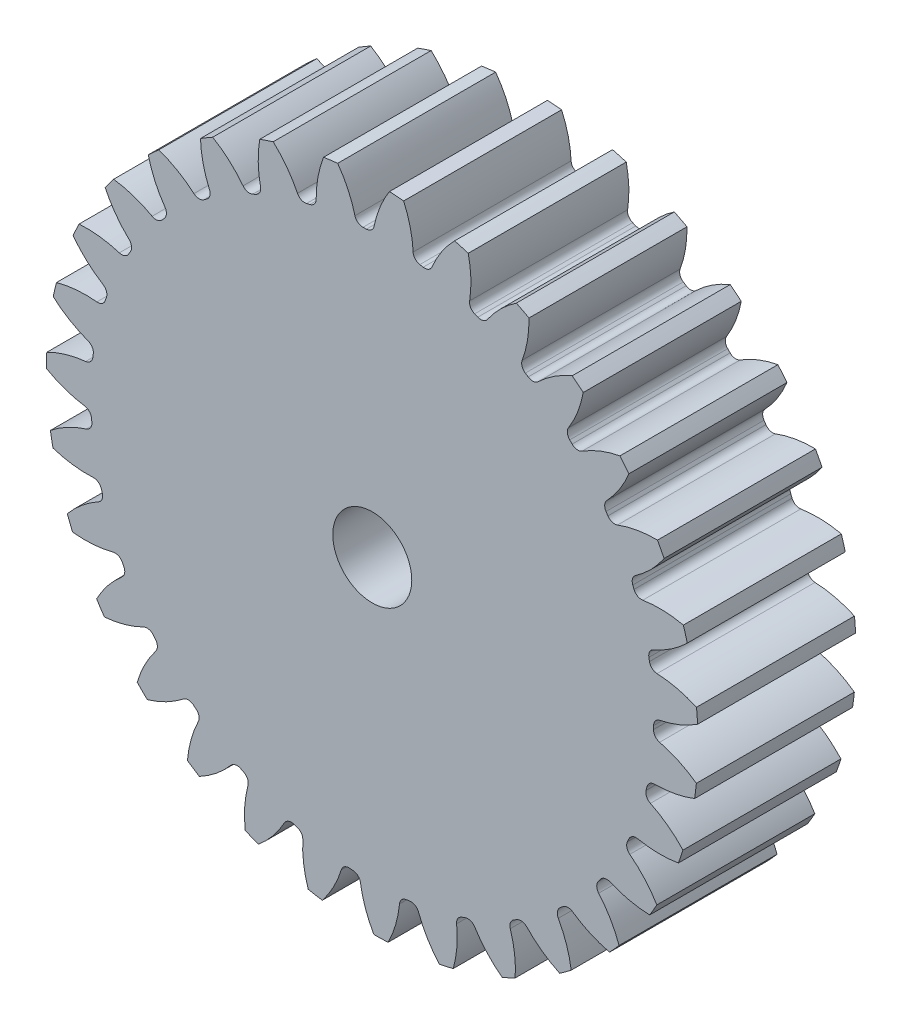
SolidWorks part; units mm, degrees
ref_plane "Front" through (0, 0, 0) normal (0, 0, 1) x (1, 0, 0)
ref_plane "Top" through (0, 0, 0) normal (0, 1, 0) x (1, 0, 0)
ref_plane "Right" through (0, 0, 0) normal (1, 0, 0) x (0, 0, -1)
sketch "Sketch3" plane through (0, 0, 0) normal (0, 0, 1) x (1, 0, 0)
  circle A0 centre (0, 0) radius 209.55
  dimension "od" = 419.1
extrude "gearBody" add sketch "Sketch3" along normal blind 101.6
sketch "Sketch2" plane through (0, 0, 0) normal (0, 0, 1) x (1, 0, 0)
  line L0 (0, 0) -> (170.8978, 70.7882) construction
  line L1 (208.7457, -21.8455) -> (0, 0) construction
  line L2 (0, 0) -> (36.3143, 0) construction
  line L3 (196.7801, 5.2441) -> (196.3061, -14.623) construction
  line L5 (196.5431, -4.6894) -> (0, 0) construction
  line L7 (0, 0) -> (184.9785, 0) construction
  arc A0 (184.9703, 1.7384) -> (184.6769, -10.558) centre (0, 0) ccw construction
  arc A1 (209.2257, 11.6537) -> (208.4318, -21.6188) centre (0, 0) ccw construction
  arc A2 (196.7801, 5.2441) -> (196.3061, -14.623) centre (0, 0) ccw construction
  arc A3 (180.8938, -5.4216) -> (180.9465, -3.2118) centre (0, 0) ccw
  arc A4 (208.7457, -21.8455) -> (184.7802, -10.5843) centre (167.3273, -78.8581) ccw
  arc A5 (208.7457, -21.8455) -> (209.55, 11.8651) centre (0, 0) ccw
  arc A6 (209.55, 11.8651) -> (185.0747, 1.7597) centre (170.8978, 70.7882) cw
  arc A7 (180.9465, -3.2118) -> (185.0747, 1.7597) centre (186.1146, -3.3035) cw
  arc A8 (184.7802, -10.5843) -> (180.8938, -5.4216) centre (186.0604, -5.5764) cw
  point P6 (209.55, 11.8651)
  point P22 (208.7457, -21.8455)
  dimension "baseDia" = 369.957
  dimension "od" = 419.1
  dimension "pd" = 393.7
  dimension "rd" = 361.95
  dimension "rFillet" = 5.1689
  dimension "pointX" = 209.55
  dimension "pointY" = 11.8651
  dimension "CTT" = 19.8672
  dimension "flankCenterAngle" = 22.5
extrude "toothCut" cut sketch "Sketch2" along normal through all
pattern_circular "CirPattern1" count 31 over 360 about axis through (0, 0, 0) along (0, 0, 1) of "toothCut"
sketch "hub1Dia" plane through (0, 0, 0) normal (0, 0, -1) x (-1, 0, 0)
  circle A0 centre (0, 0) radius 12.7
  dimension "hub1Dia" = 25.4
sketch "hub2Dia" plane through (0, 0, 101.6) normal (0, 0, 1) x (1, 0, 0)
  circle A0 centre (0, 0) radius 12.7
  dimension "hub2dia" = 25.4
sketch "boreDia" plane through (0, 0, 0) normal (0, 0, 1) x (1, 0, 0)
  circle A0 centre (0, 0) radius 25.4
  dimension "boreDia" = 50.8
extrude "bore" cut sketch "boreDia" against normal mid plane 25400
